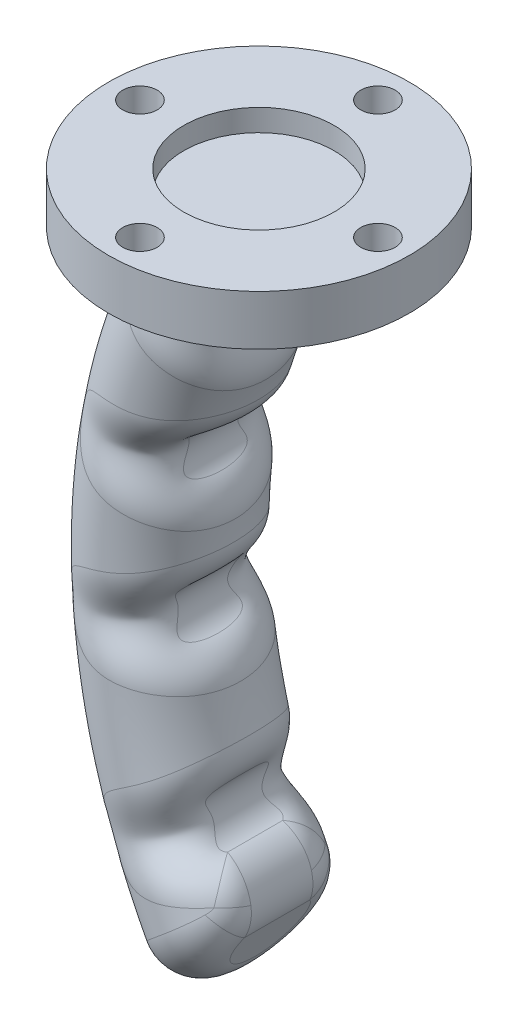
SolidWorks part; units mm, degrees
ref_plane "Front Plane" through (0, 0, 0) normal (0, 0, 1) x (1, 0, 0)
ref_plane "Top Plane" through (0, 0, 0) normal (0, 1, 0) x (1, 0, 0)
ref_plane "Right Plane" through (0, 0, 0) normal (1, 0, 0) x (0, 0, -1)
sketch "Sketch1" plane through (0, 0, 0) normal (0, 1, 0) x (1, 0, 0)
  circle A0 centre (0, 0) radius 24
  dimension "D1" = 48
extrude "Boss-Extrude1" add sketch "Sketch1" along normal blind 8
ref_plane "Plane1" through (0, -30, 0) normal (0, -1, 0) x (-1, 0, 0)
ref_plane "Plane2" through (0, -100, 0) normal (0, -1, 0) x (-1, 0, 0)
sketch "Sketch5" plane through (0, 0, 0) normal (0, -1, 0) x (1, 0, 0)
  circle A0 centre (0, 0) radius 12
  dimension "D1" = 24
sketch "Sketch6" plane through (0, -30, 0) normal (0, -1, 0) x (-1, 0, 0)
  circle A0 centre (12, 0) radius 12
  dimension "D1" = 24
  dimension "D2" = 12
sketch "Sketch7" plane through (0, -100, 0) normal (0, -1, 0) x (-1, 0, 0)
  circle A0 centre (0, 0) radius 12
sketch "Sketch8" plane through (0, 0, 0) normal (0, 0, 1) x (1, 0, 0)
  line L2 (-24, 0) -> (24, 0) construction
  line L3 (-12, -100) -> (12, -100) construction
  arc A0 (0, 0) -> (0, -100) centre (81.575, -50) ccw
sweep "Sweep1" add profiles "Sketch5" path "Sketch8"
fillet "Fillet4" radius 6 1 edges at (0, -100, -12)
sketch "Sketch16" [suppressed] plane through (0, 0, 0) normal (0, 0, 1) x (1, 0, 0)
  line L0 (-0.6307, -101.2383) -> (4.0791, -91.9905)
  line L1 (-12, 0) -> (12, 0)
  arc A0 (-11.2253, -101.4235) -> (-0.6307, -101.2383) centre (-5.9772, -98.5154) ccw
sketch "Sketch17" plane through (0, 0, 0) normal (0, 0, 1) x (1, 0, 0)
  line L0 (4.7852, -7.4094) -> (4.7852, -21.8377)
  line L1 (-5.4458, -110.6931) -> (5.4458, -89.3069) construction
  line L2 (-11.2253, -101.4235) -> (4.1543, -86.6976)
  line L3 (-12, 0) -> (12, 0)
  line L4 (-68.9761, -80) -> (77.5035, -80)
  line L5 (-2.3993, -28.4508) -> (-2.3993, -40.1729)
  line L6 (90.4641, -100) -> (-70.9324, -100)
  line L7 (65.2765, -55) -> (-77.7796, -55)
  line L8 (1.3211, -69.7141) -> (1.3211, -91.427)
  line L9 (63.5647, -33) -> (-83.8931, -33)
  line L10 (-3.9568, -66.0159) -> (-3.9568, -41.9035)
  line L11 (70.1673, -12) -> (-77.7796, -12)
  arc A2 (0, 0) -> (0, -100) centre (81.575, -50) ccw
  arc A3 (12, 0) -> (4.1543, -86.6976) centre (81.575, -50) ccw construction
  arc A4 (4.1543, -86.6976) -> (12, 0) centre (81.575, -50) cw
  arc A5 (-12, 0) -> (-11.2253, -101.4235) centre (81.575, -50) ccw
  arc A6 (-12, 0) -> (-11.2253, -101.4235) centre (81.575, -50) ccw construction
  point P4 (4.7852, -12)
  point P35 (-2.3993, -33)
  point P38 (-3.9568, -55)
  point P39 (1.3211, -80)
  dimension "D1" = 0
  dimension "D2" = 0
  dimension "D3" = 0
  dimension "D4" = 12
  dimension "D5" = 33
  dimension "D6" = 55
  dimension "D7" = 80
ref_plane "Plane3" through (1.3211, 0, 0) normal (1, 0, 0) x (0, 0, -1)
ref_plane "Plane4" through (-3.9568, 0, 0) normal (1, 0, 0) x (0, 0, -1)
ref_plane "Plane5" through (-2.3993, 0, 0) normal (1, 0, 0) x (0, 0, -1)
ref_plane "Plane6" through (4.7852, 0, 0) normal (1, 0, 0) x (0, 0, -1)
sketch "Sketch18" plane through (1.3211, 0, 0) normal (1, 0, 0) x (0, 0, -1)
  line L0 (-12, -80) -> (12, -80)
  line L1 (-12, 0) -> (-12, -93.7162) construction
  line L2 (12, -93.7162) -> (12, 0) construction
  line L3 (12, -80) -> (12, -85)
  line L4 (12, -93.7162) -> (12, 0) construction
  line L5 (12, -85) -> (-12, -85)
  line L6 (-12, 0) -> (-12, -93.7162) construction
  line L7 (-12, -85) -> (-12, -80)
  dimension "D1" = 5
  dimension "D2" = 0
revolve "Cut-Revolve3" cut sketch "Sketch18" angle 360 about L0
sketch "Sketch19" plane through (-3.9568, 0, 0) normal (1, 0, 0) x (0, 0, -1)
  line L1 (-12, -55) -> (11.9282, -55)
  line L2 (-12, 0) -> (-12, -93.7162) construction
  line L3 (11.9282, -55) -> (11.9282, -60)
  line L4 (11.9282, -60) -> (-12, -60)
  line L5 (-12, -60) -> (-12, -55)
  dimension "D1" = 5
revolve "Cut-Revolve4" cut sketch "Sketch19" angle 360 about L1
sketch "Sketch20" plane through (-2.3993, 0, 0) normal (1, 0, 0) x (0, 0, -1)
  line L0 (-12, -33) -> (12, -33)
  line L1 (12, -93.7162) -> (12, 0) construction
  line L3 (12, -33) -> (12, -38)
  line L5 (-12, 0) -> (-12, -93.7162) construction
  line L7 (12, -38) -> (-12, -38)
  line L8 (-12, -38) -> (-12, -33)
  dimension "D1" = 5
revolve "Cut-Revolve5" cut sketch "Sketch20" angle 360 about L0
sketch "Sketch21" plane through (4.7852, 0, 0) normal (1, 0, 0) x (0, 0, -1)
  line L4 (-12, -12) -> (12, -12)
  line L5 (12, -12) -> (12, -17)
  line L6 (12, -17) -> (-12, -17)
  line L7 (-12, -17) -> (-12, -12)
  dimension "D1" = 24
  dimension "D3" = 5
revolve "Cut-Revolve6" cut sketch "Sketch21" angle 360 about L4
fillet "Fillet7" radius 7 4 edges at (1.3185, -8.3969, 10.2361) (-6.2354, -29.7931, 10.012) (-7.1375, -51.1422, 8.6796) (-3.5303, -78.7902, 9.7962)
sketch "Sketch23" plane through (0, 8, 0) normal (0, 1, 0) x (1, 0, 0)
  circle A0 centre (0, 0) radius 12
  dimension "D1" = 24
extrude "Cut-Extrude4" cut sketch "Sketch23" against normal blind 3.5 contours A0
sketch "Sketch24" plane through (0, 8, 0) normal (0, 1, 0) x (1, 0, 0)
  circle A0 centre (-19, 0) radius 2.75
  circle A1 centre (0, 19) radius 2.75
  circle A2 centre (19, 0) radius 2.75
  circle A3 centre (0, -19) radius 2.75
  point P11 (0, 0)
  dimension "D1" = 5.5
  dimension "D2" = 19
  dimension "D3" = 4
extrude "Cut-Extrude5" cut sketch "Sketch24" against normal blind 5.5
